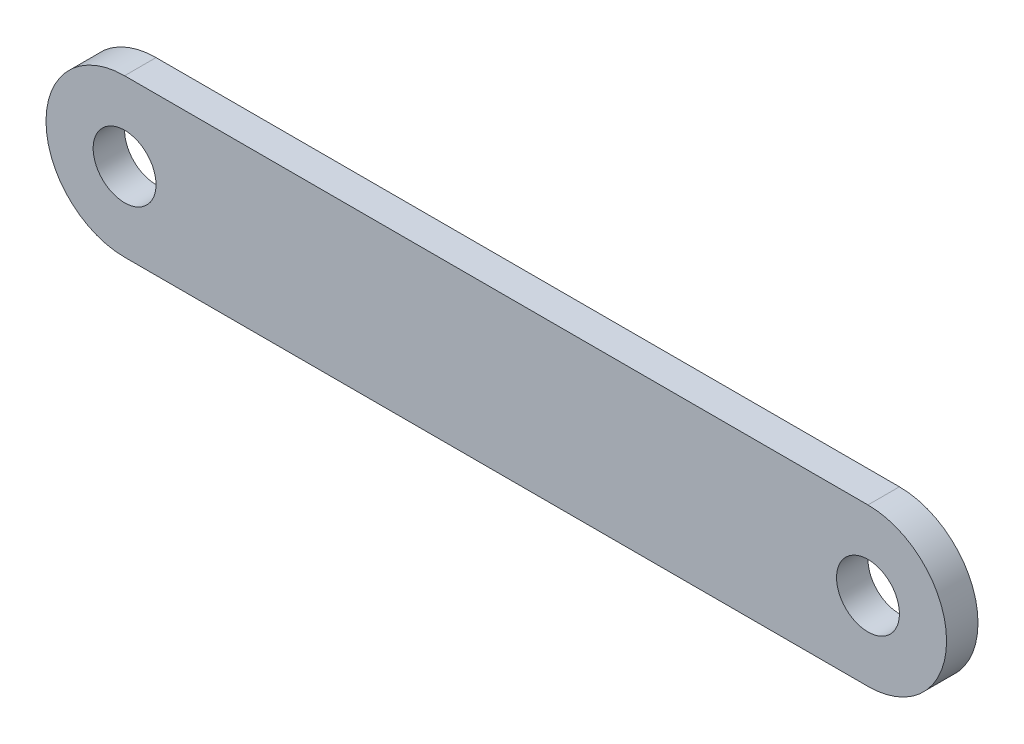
SolidWorks part; units mm, degrees
ref_plane "Front Plane" through (0, 0, 0) normal (0, 0, 1) x (1, 0, 0)
ref_plane "Top Plane" through (0, 0, 0) normal (0, 1, 0) x (1, 0, 0)
ref_plane "Right Plane" through (0, 0, 0) normal (1, 0, 0) x (0, 0, -1)
sketch "Sketch1" plane through (0, 0, 0) normal (0, 0, 1) x (1, 0, 0)
  line L0 (-59.1204, 0) -> (59.1204, 0) construction
  line L1 (-59.1204, 12.5) -> (59.1204, 12.5)
  line L2 (-59.1204, -12.5) -> (59.1204, -12.5)
  arc A0 (-59.1204, 12.5) -> (-59.1204, -12.5) centre (-59.1204, 0) ccw
  arc A1 (59.1204, -12.5) -> (59.1204, 12.5) centre (59.1204, 0) ccw
  point P2 (0, 0)
  dimension "D1" = 118.2407
  dimension "D3" = 25
extrude "Boss-Extrude1" add sketch "Sketch1" along normal blind 5
hole_wizard "M8 Clearance Hole1" positions "Sketch4" profile "Sketch5" hole size "M8" standard "ANSI Metric"
sketch "Sketch4" plane through (0, 0, 5) normal (0, 0, 1) x (1, 0, 0)
  point P0 (-59.1204, 0)
  point P3 (59.1204, 0)
sketch "Sketch5" plane through (-59.1204, 0, 5) normal (1, 0, 0) x (0, -1, 0)
  line L0 (0, 0) -> (0, 5)
  line L1 (0, 5) -> (5, 5)
  line L2 (5, 5) -> (5, 0)
  line L5 (5, 0) -> (0, 0)
  line L11 (0, -6.35) -> (0, 107.95) construction
  dimension "Thru Hole Dia." = 10
  dimension "Thru Hole Depth" = 5
